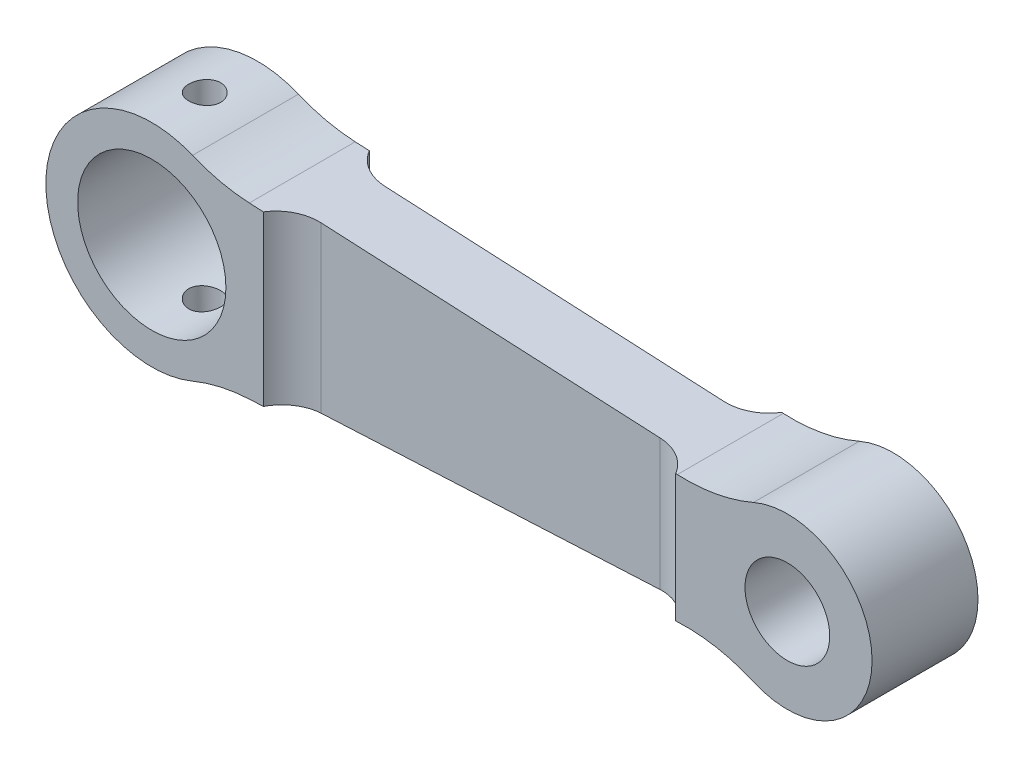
SolidWorks part; units mm, degrees
ref_plane "Face" through (0, 0, 0) normal (0, 0, 1) x (1, 0, 0)
ref_plane "Dessus" through (0, 0, 0) normal (0, 1, 0) x (1, 0, 0)
ref_plane "Droite" through (0, 0, 0) normal (1, 0, 0) x (0, 0, -1)
sketch "Esquisse1" plane through (0, 0, 0) normal (0, 0, 1) x (1, 0, 0)
  line L0 (4.6045, -4.0098) -> (24.8087, -3.0098)
  line L1 (24.8087, 3.0098) -> (4.6045, 4.0098)
  arc A0 (1.9231, 4.6154) -> (4.6045, 4.0098) centre (5, 12) ccw
  arc A1 (28.4014, -3.6667) -> (28.4014, 3.6667) centre (30, 0) ccw
  circle A2 centre (30, 0) radius 2
  arc A3 (1.9231, 4.6154) -> (1.9231, -4.6154) centre (0, 0) ccw
  arc A4 (1.9231, -4.6154) -> (4.6045, -4.0098) centre (5, -12) cw
  arc A5 (24.8087, -3.0098) -> (28.4014, -3.6667) centre (25.2042, -11) cw
  arc A6 (24.8087, 3.0098) -> (28.4014, 3.6667) centre (25.2042, 11) ccw
  circle A7 centre (0, 0) radius 3.5
  dimension "D3" = 8
  dimension "D4" = 4
  dimension "D5" = 10
  dimension "D6" = 8
  dimension "D7" = 8
  dimension "D8" = 8
  dimension "D9" = 7
  dimension "D14" = 16
  dimension "D2" = 30
  dimension "D10" = 22
  dimension "D11" = 11
  dimension "D12" = 12
  dimension "D13" = 12
extrude "Base-Extrusion" add sketch "Esquisse1" along normal mid plane 5
sketch "Esquisse2" plane through (0, 0, 0) normal (0, 1, 0) x (1, 0, 0)
  line L1 (5, 6.563) -> (25, 6.563)
  line L2 (5, 6.563) -> (5, 3.5)
  line L3 (7, 1.5) -> (23, 1.5)
  line L4 (25, 6.563) -> (25, 3.5)
  line L5 (5, -5.9545) -> (25, -5.9545)
  line L6 (5, -5.9545) -> (5, -3.5)
  line L7 (7, -1.5) -> (23, -1.5)
  line L8 (25, -5.9545) -> (25, -3.5)
  line L10 (24.8087, -2.5) -> (4.6045, -2.5) construction
  line L11 (24.8087, 2.5) -> (4.6045, 2.5) construction
  arc A0 (5, -3.5) -> (7, -1.5) centre (7, -3.5) cw
  arc A1 (23, -1.5) -> (25, -3.5) centre (23, -3.5) cw
  arc A2 (7, 1.5) -> (5, 3.5) centre (7, 3.5) cw
  arc A3 (23, 1.5) -> (25, 3.5) centre (23, 3.5) ccw
  circle A4 centre (0, 0) radius 0.75
  dimension "D6" = 2
  dimension "D7" = 2
  dimension "D8" = 2
  dimension "D9" = 2
  dimension "D10" = 1.5
  dimension "D1" = 20
  dimension "D2" = 20
  dimension "D3" = 5
  dimension "D4" = 1
  dimension "D5" = 1
extrude "Enlèv. mat.-Extru.1" cut sketch "Esquisse2" against normal mid plane 20
